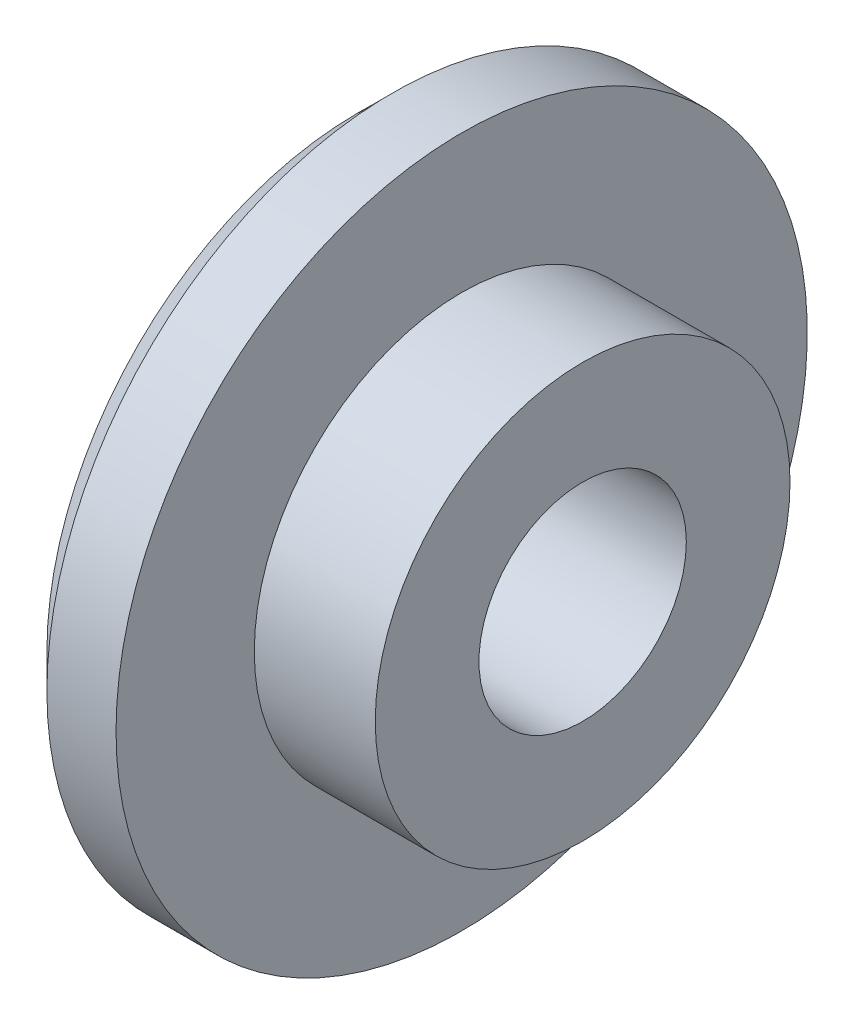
SolidWorks part; units mm, degrees
ref_plane "Front" through (0, 0, 0) normal (0, 0, 1) x (1, 0, 0)
ref_plane "Top" through (0, 0, 0) normal (0, 1, 0) x (1, 0, 0)
ref_plane "Right" through (0, 0, 0) normal (1, 0, 0) x (0, 0, -1)
sketch "Sketch1" plane through (0, 0, 0) normal (0, 1, 0) x (1, 0, 0)
  line L0 (0, 0) -> (6.5, 0)
  line L1 (6.5, 0) -> (6.5, 6)
  line L2 (6.5, 6) -> (3, 6)
  line L3 (3, 6) -> (3, 10)
  line L4 (3, 10) -> (0, 10)
  line L5 (0, 10) -> (0, 0)
revolve "Revolve1" add sketch "Sketch1" angle 360 about L0
sketch "Sketch2" plane through (6.5, 0, 0) normal (1, 0, 0) x (0, 0, -1)
  circle A0 centre (0, 0) radius 3
extrude "Cut-Extrude1" cut sketch "Sketch2" against normal through all
chamfer "Chamfer1" distance 1 angle 45 1 edges at (0, 0, 10)
